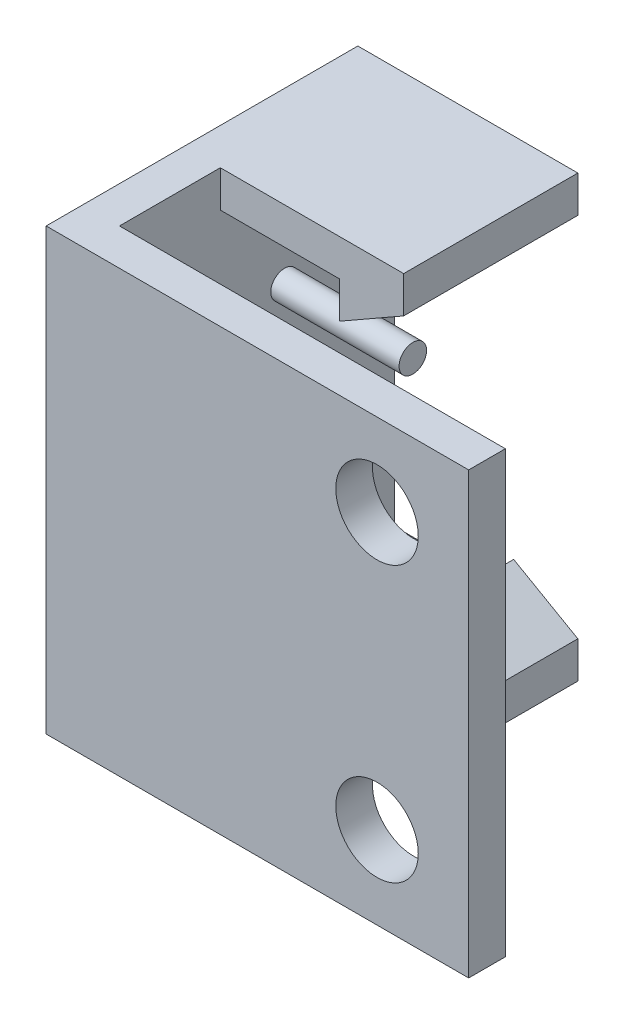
SolidWorks part; units mm, degrees
ref_plane "Ebene vorne" through (0, 0, 0) normal (0, 0, 1) x (1, 0, 0)
ref_plane "Ebene oben" through (0, 0, 0) normal (0, 1, 0) x (1, 0, 0)
ref_plane "Ebene rechts" through (0, 0, 0) normal (1, 0, 0) x (0, 0, -1)
sketch "Skizze1" plane through (0, 0, 0) normal (1, 0, 0) x (0, 0, -1)
  line L1 (0, 0) -> (15, 0)
  line L2 (0, 0) -> (0, 24)
  line L3 (0, 24) -> (15, 24)
  line L4 (15, 0) -> (15, 24)
  dimension "D1" = 15
  dimension "D2" = 24
extrude "Aufsatz-Linear austragen1" add sketch "Skizze1" along normal blind 2
sketch "Skizze2" plane through (2, 0, 0) normal (1, 0, 0) x (0, 0, -1)
  line L0 (15, 0) -> (15, 24) construction
  line L1 (0, 24) -> (15, 24)
  line L2 (0, 24) -> (0, 22)
  line L3 (0, 22) -> (15, 22)
  line L4 (15, 24) -> (15, 22)
  line L6 (0, 0) -> (15, 0)
  line L7 (0, 0) -> (0, 2)
  line L8 (0, 2) -> (15, 2)
  line L9 (15, 0) -> (15, 2)
  dimension "D1" = 20
  dimension "D2" = 2
extrude "Aufsatz-Linear austragen2" add sketch "Skizze2" along normal blind 10
sketch "Skizze3" plane through (0, 0, -15) normal (0, 0, -1) x (-1, 0, 0)
  line L0 (-12, 22) -> (-8.5, 20)
  line L1 (-8.5, 20) -> (-8.5, 22)
  line L2 (-12, 22) -> (-2, 22) construction
  line L3 (-2, 2) -> (-2, 22) construction
  line L4 (-12, 2) -> (-8.5, 4)
  line L5 (-8.5, 4) -> (-8.5, 2)
  line L6 (-12, 2) -> (-2, 2) construction
  line L7 (-12, 22) -> (-8.5, 22)
  line L8 (-12, 2) -> (-8.5, 2)
  dimension "D1" = 6.5
  dimension "D2" = 2
  dimension "D3" = 2
extrude "Aufsatz-Linear austragen3" add sketch "Skizze3" against normal blind 10
sketch "Skizze5" plane through (2, 0, 0) normal (1, 0, 0) x (0, 0, -1)
  line L0 (0, 22) -> (5, 22) construction
  line L2 (15, 2) -> (15, 22) construction
  circle A0 centre (9, 16.75) radius 0.75
  circle A1 centre (9, 7.25) radius 0.75
  dimension "D1" = 1.5
  dimension "D2" = 1.5
  dimension "D3" = 9.5
  dimension "D4" = 5.25
  dimension "D5" = 6
sketch "Skizze7" plane through (0, 0, 0) normal (0, 0, 1) x (1, 0, 0)
  line L1 (0, 24) -> (23.0459, 24)
  line L2 (0, 24) -> (0, 0)
  line L3 (0, 0) -> (23.0459, 0)
  line L4 (23.0459, 24) -> (23.0459, 0)
  circle A0 centre (18.0459, 19.5) radius 2.25
  circle A1 centre (18.0459, 4.5) radius 2.25
  dimension "D1" = 4.5
  dimension "D2" = 4.5
  dimension "D3" = 5
  dimension "D4" = 5
  dimension "D5" = 15
  dimension "D6" = 4.5
extrude "Aufsatz-Linear austragen4" add sketch "Skizze7" along normal blind 2
extrude "Aufsatz-Linear austragen5" add sketch "Skizze5" along normal blind 7
sketch "Skizze8" plane through (0, 24, 0) normal (0, 1, 0) x (1, 0, 0)
  line L0 (0, 15) -> (0, -2) construction
  line L1 (12, 0) -> (2, 0)
  line L2 (12, 0) -> (12, 5.5)
  line L3 (12, 5.5) -> (2, 5.5)
  line L4 (2, 0) -> (2, 5.5)
  dimension "D1" = 2
  dimension "D2" = 5.5
extrude "Schnitt-Linear austragen2" cut sketch "Skizze8" against normal blind 27
